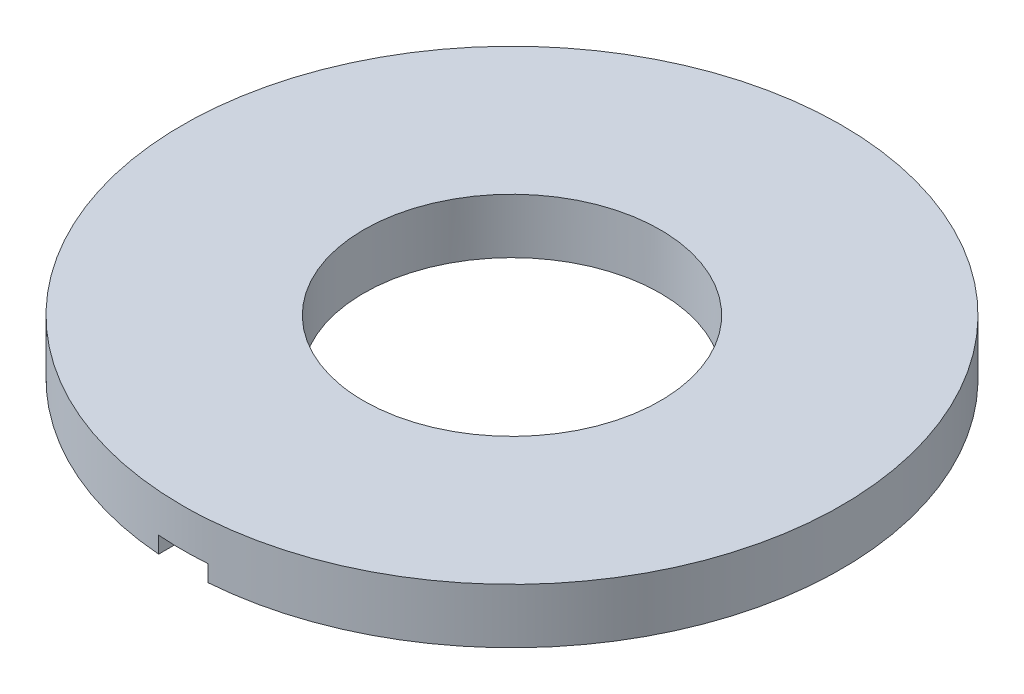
SolidWorks part; units mm, degrees
ref_plane "Front Plane" through (0, 0, 0) normal (0, 0, 1) x (1, 0, 0)
ref_plane "Top Plane" through (0, 0, 0) normal (0, 1, 0) x (1, 0, 0)
ref_plane "Right Plane" through (0, 0, 0) normal (1, 0, 0) x (0, 0, -1)
sketch "Sketch1" plane through (0, 0, 0) normal (0, 1, 0) x (1, 0, 0)
  circle A0 centre (0, 0) radius 1.35
  circle A1 centre (0, 0) radius 3
  dimension "D1" = 2.7
  dimension "D2" = 6
extrude "Extrude1" add sketch "Sketch1" along normal blind 0.5
sketch "Sketch2" plane through (0, 0, 0) normal (0, -1, 0) x (1, 0, 0)
  line L1 (-0.225, -0.3) -> (0.225, -0.3)
  line L2 (-0.225, -0.3) -> (-0.225, 3)
  line L3 (-0.225, 3) -> (0.225, 3)
  line L4 (0.225, -0.3) -> (0.225, 3)
  line L5 (-0.225, -0.3) -> (0.225, 3) construction
  line L6 (-0.225, 3) -> (0.225, -0.3) construction
  circle A0 centre (0, 0) radius 1.35 construction
  circle A1 centre (0, 0) radius 3 construction
  point P0 (0, 1.35)
  dimension "D1" = 0.45
extrude "Cut-Extrude1" cut sketch "Sketch2" against normal blind 0.15
